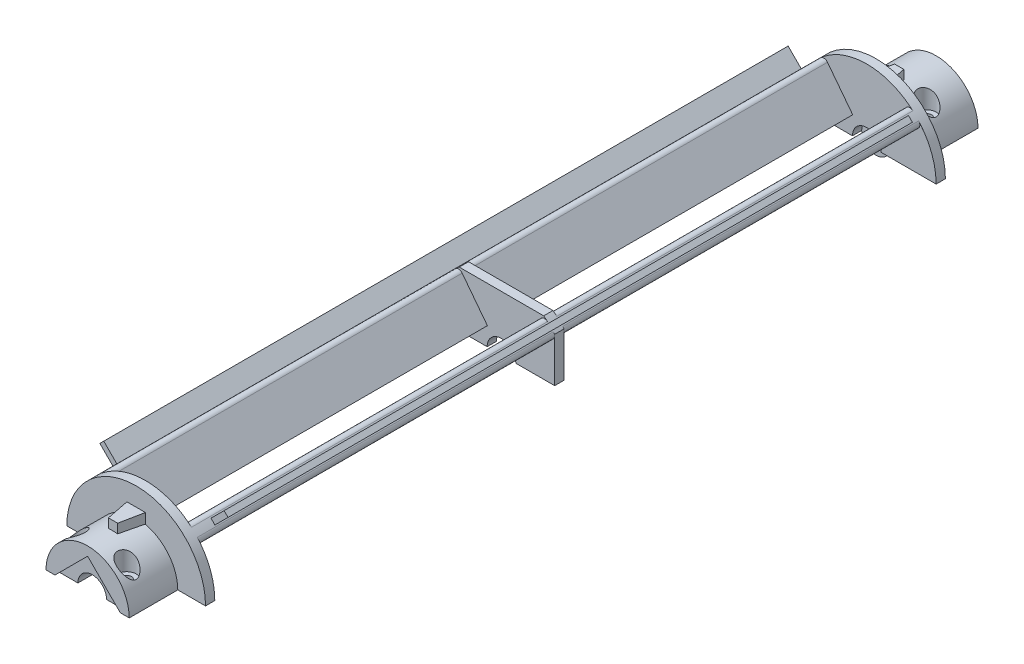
SolidWorks part; units mm, degrees
ref_plane "Face" through (0, 0, 0) normal (0, 0, 1) x (1, 0, 0)
ref_plane "Dessus" through (0, 0, 0) normal (0, 1, 0) x (1, 0, 0)
ref_plane "Droite" through (0, 0, 0) normal (1, 0, 0) x (0, 0, -1)
sketch "Esquisse1" plane through (0, 0, 0) normal (0, 0, 1) x (1, 0, 0)
  line L0 (3.1, 0) -> (11.5, 0)
  line L1 (-3.1, 0) -> (-11.5, 0)
  line L2 (0, 0) -> (0, 15) construction
  line L3 (11.5, 0) -> (11.5, 9.6307)
  line L4 (-11.5, 0) -> (-11.5, 9.6307)
  line L5 (-9.1314, 11.9003) -> (9.1314, 11.9003)
  line L6 (0, 0) -> (9.1314, 11.9003) construction
  arc A0 (11.5, 9.6307) -> (9.1314, 11.9003) centre (0, 0) ccw
  arc A1 (3.1, 0) -> (-3.1, 0) centre (0, 0) ccw
  arc A2 (-9.1314, 11.9003) -> (-11.5, 9.6307) centre (0, 0) ccw
  dimension "D1" = 30
  dimension "D2" = 6.2
  dimension "D3" = 23
  dimension "D4" = 52.5
extrude "Flasque central" add sketch "Esquisse1" along normal mid plane 2
sketch "Esquisse2" plane through (0, 0, 0) normal (0, 0, 1) x (1, 0, 0)
  line L0 (3.9668, 3.0438) -> (11.0786, 8.5009)
  line L1 (3.0438, 3.9668) -> (8.5009, 11.0786)
  line L3 (0, 0) -> (10.6066, 10.6066) construction
  line L4 (3.1, 0) -> (11.5, 0) construction
  arc A0 (11.5, 9.6307) -> (9.1314, 11.9003) centre (0, 0) ccw construction
  arc A1 (3.9668, 3.0438) -> (3.0438, 3.9668) centre (0, 0) ccw
  arc A2 (11.2177, 9.9581) -> (9.9581, 11.2177) centre (0, 0) ccw
  arc A3 (11.2177, 9.9581) -> (11.0786, 8.5009) centre (10.4698, 9.2942) cw
  arc A4 (8.5009, 11.0786) -> (9.9581, 11.2177) centre (9.2942, 10.4698) cw
  point P16 (9.1314, 11.9003)
  dimension "D1" = 5
  dimension "D5" = 1
  dimension "D6" = 1
  dimension "D2" = 15
  dimension "D3" = 7.5
  dimension "D4" = 45
extrude "Barre" add sketch "Esquisse2" along normal blind 80 and the other way blind 78
mirror "Symétrie barre" about plane through (0, 0, 0) normal (1, 0, 0) of "Barre"
sketch "Esquisse3" plane through (0, 0, 80) normal (0, 0, 1) x (1, 0, 0)
  line L0 (9, 0) -> (3.1, 0)
  line L1 (-3.1, 0) -> (-9, 0)
  arc A0 (9, 0) -> (-9, 0) centre (0, 0) ccw
  arc A1 (3.1, 0) -> (-3.1, 0) centre (0, 0) ccw construction
  arc A2 (3.1, 0) -> (-3.1, 0) centre (0, 0) ccw
  dimension "D1" = 18
extrude "Bout avant" add sketch "Esquisse3" along normal blind 10.5
ref_plane "Plan1" through (0, 4, 0) normal (0, 1, 0) x (-1, 0, 0)
sketch "Esquisse4" plane through (0, 4, 0) normal (0, 1, 0) x (-1, 0, 0)
  line L0 (0, 90.5) -> (0, 80) construction
  line L4 (9, 90.5) -> (-9, 90.5) construction
  circle A0 centre (-5.5, 87.5) radius 2
  dimension "D1" = 4
  dimension "D3" = 3
  dimension "D2" = 5.5
extrude "Lamage vis " cut sketch "Esquisse4" along normal through all
sketch "Esquisse5" plane through (0, 4, 0) normal (0, 1, 0) x (-1, 0, 0)
  circle A0 centre (-5.5, 87.5) radius 1
  dimension "D1" = 2
extrude "Passage vis" cut sketch "Esquisse5" against normal through all
mirror "Symétrie passage vis" about plane through (0, 0, 0) normal (1, 0, 0) of "Lamage vis ", "Passage vis"
sketch "Esquisse6" plane through (0, 0, 90.5) normal (0, 0, 1) x (1, 0, 0)
  line L0 (0, 0) -> (0, 7.0711) construction
  line L1 (0, 7.0711) -> (7.0711, 0)
  line L3 (0, 7.0711) -> (-7.0711, 0)
  line L4 (3.1, 0) -> (9, 0) construction
  line L5 (7.0711, 0) -> (-7.0711, 0)
  dimension "D1" = 10
extrude "Logement carré" cut sketch "Esquisse6" against normal blind 1
sketch "Esquisse8" plane through (0, 0, 0) normal (0, 1, 0) x (1, 0, 0)
  line L0 (0, 0) -> (0, 92.8072) construction
  line L1 (3.1, 80) -> (15, 80)
  line L2 (15, 80) -> (15, 78)
  line L3 (3.1, 78) -> (15, 78)
  line L4 (8.5009, 78) -> (3.0438, 78) construction
  line L6 (3.1, 80) -> (3.1, 78)
  dimension "D1" = 2
  dimension "D2" = 15
  dimension "D3" = 6.2
revolve "Flasque arrière" add sketch "Esquisse8" angle 180 about L0
sketch "Esquisse9" plane through (0, 0, -80) normal (0, 0, -1) x (-1, 0, 0)
  line L0 (-15, 0) -> (-3.1, 0) construction
  line L1 (15, 0) -> (3.1, 0) construction
  line L2 (9.05, 0) -> (3.1, 0)
  line L3 (-9.05, 0) -> (-3.1, 0)
  arc A0 (-9.05, 0) -> (9.05, 0) centre (0, 0) cw
  arc A2 (-3.1, 0) -> (3.1, 0) centre (0, 0) ccw
  circle A3 centre (0, 0) radius 1.5
  dimension "D1" = 3
extrude "Extrusion2" add sketch "Esquisse9" along normal blind 13
sketch "Esquisse10" plane through (0, 0, -93) normal (0, 0, -1) x (-1, 0, 0)
  circle A0 centre (0, 0) radius 7.5
  dimension "D1" = 15
extrude "Lamage arrière" cut sketch "Esquisse10" against normal blind 4.5
mirror "Symétrie1" about plane through (0, 0, 1) normal (0, 0, 1) of "Symétrie passage vis", "Lamage vis ", "Passage vis"
sketch "Esquisse11" plane through (0, 0, 80) normal (0, 0, 1) x (1, 0, 0)
  line L0 (15, 0) -> (1.5, 0)
  line L1 (-1.5, 0) -> (-15, 0)
  arc A0 (15, 0) -> (-15, 0) centre (0, 0) ccw
  circle A1 centre (0, 0) radius 1.5 construction
  arc A2 (1.5, 0) -> (-1.5, 0) centre (0, 0) ccw
  dimension "D1" = 30
extrude "Extrusion3" add sketch "Esquisse11" against normal blind 2
ref_plane "Plan2" through (0, 11, 0) normal (0, -1, 0) x (1, 0, 0)
sketch "Esquisse12" plane through (0, 11, 0) normal (0, -1, 0) x (1, 0, 0)
  line L0 (0, -74.3951) -> (0, -98.6177) construction
  line L1 (0, -1) -> (0, -78) construction
  line L2 (-2, -80) -> (2, -80)
  line L3 (-15, -80) -> (15, -80) construction
  line L4 (-1, -85) -> (1, -85)
  line L5 (1, -85) -> (2, -80)
  line L6 (-9.05, -80) -> (9.05, -80) construction
  line L7 (-1, -85) -> (-2, -80)
  line L8 (-1, 85) -> (1, 85)
  line L9 (0, 89.5) -> (0, 80) construction
  line L10 (1, 85) -> (2, 80)
  line L11 (9, 80) -> (-9, 80) construction
  line L12 (2, 80) -> (-2, 80)
  line L14 (0, 77.6596) -> (0, 86.668) construction
  line L15 (0, 0) -> (0, 92.8072) construction
  line L16 (-1, 85) -> (-2, 80)
  point P9 (0, -80)
  point P15 (0, -85)
  point P24 (0, 80)
  point P29 (0, 85)
  dimension "D1" = 1
  dimension "D2" = 2
  dimension "D3" = 5
  dimension "D4" = 1
  dimension "D5" = 2
  dimension "D6" = 5
extrude "Extrusion4" add sketch "Esquisse12" along normal up to surface (2.0054 mm away)
ref_plane "Plan3" through (0, 0, -74) normal (0, 0, 1) x (1, 0, 0)
sketch "Esquisse13" plane through (0, 0, -74) normal (0, 0, 1) x (1, 0, 0)
  line L0 (0, 0) -> (13.435, 13.435) construction
  line L1 (9, 0) -> (15, 0) construction
  line L4 (13.0108, 13.8593) -> (9.7581, 10.6066)
  line L5 (9.7581, 10.6066) -> (10.6066, 9.7581)
  line L6 (13.0108, 13.8593) -> (13.8593, 13.0108)
  line L7 (13.8593, 13.0108) -> (10.6066, 9.7581)
  point P19 (10.1823, 10.1823)
  dimension "D2" = 45
  dimension "D3" = 19
  dimension "D4" = 0.6
  dimension "D5" = 4.6
extrude "Extrusion5" add sketch "Esquisse13" along normal blind 148
mirror "Symétrie2" about plane through (0, 0, 0) normal (1, 0, 0) of "Extrusion5"
